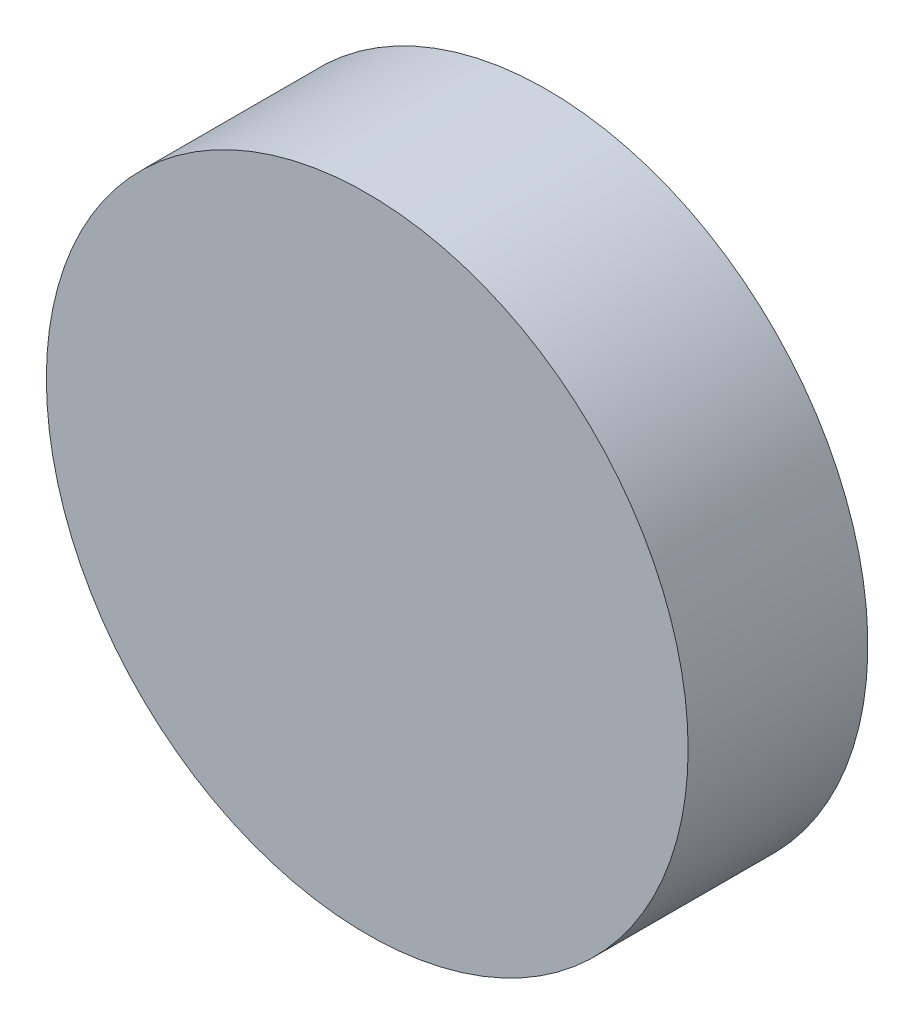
SolidWorks part; units mm, degrees
ref_plane "Plan de face" through (0, 0, 0) normal (0, 0, 1) x (1, 0, 0)
ref_plane "Plan de dessus" through (0, 0, 0) normal (0, 1, 0) x (1, 0, 0)
ref_plane "Plan de droite" through (0, 0, 0) normal (1, 0, 0) x (0, 0, -1)
imported_body "Importée1"
sketch "Esquisse1" plane through (0, 0, -7.5) normal (0, 0, -1) x (-1, 0, 0)
  circle A0 centre (0, 0) radius 12.5
  dimension "D1" = 25
extrude "Extrusion1" cut sketch "Esquisse1" against normal blind 30 flip side to cut
sketch "Esquisse2" plane through (0, 0, -7.5) normal (0, 0, -1) x (-1, 0, 0)
  line L1 (-42.9329, 14.5375) -> (33.6114, 14.5375)
  line L2 (-42.9329, 14.5375) -> (-42.9329, -27.7415)
  line L3 (-42.9329, -27.7415) -> (33.6114, -27.7415)
  line L4 (33.6114, 14.5375) -> (33.6114, -27.7415)
extrude "Extrusion2" cut sketch "Esquisse2" against normal blind 8
